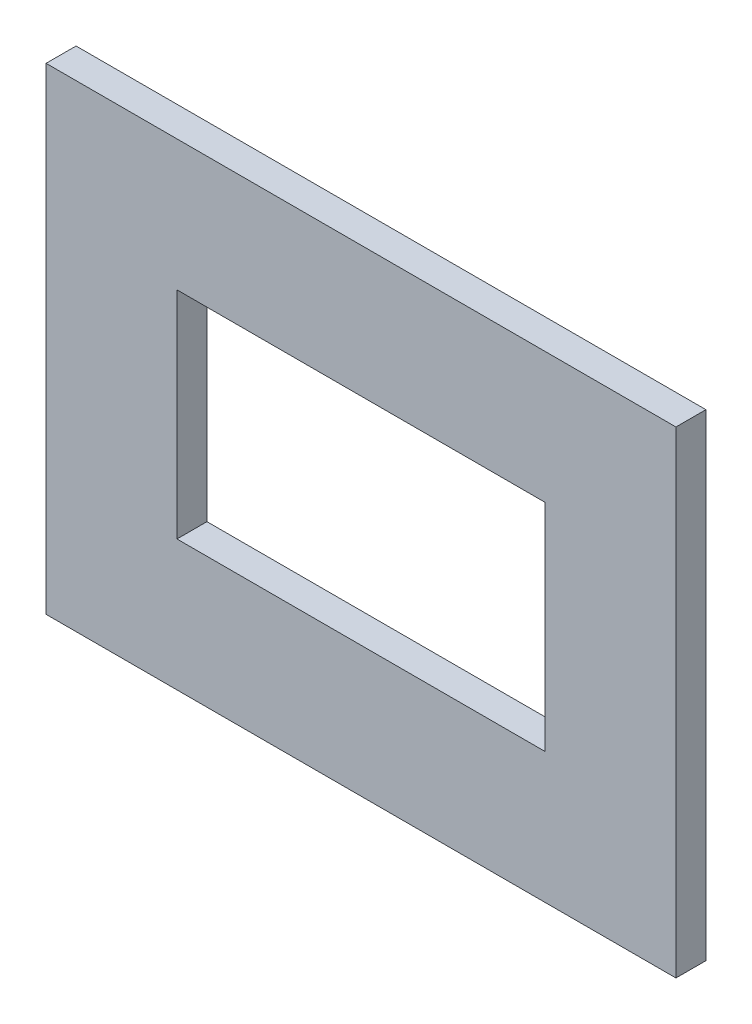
SolidWorks part; units mm, degrees
ref_plane "Front Plane" through (0, 0, 0) normal (0, 0, 1) x (1, 0, 0)
ref_plane "Top Plane" through (0, 0, 0) normal (0, 1, 0) x (1, 0, 0)
ref_plane "Right Plane" through (0, 0, 0) normal (1, 0, 0) x (0, 0, -1)
sketch "Sketch1" plane through (0, 0, 0) normal (0, 0, 1) x (1, 0, 0)
  line L1 (92.075, -53.975) -> (-92.075, -53.975)
  line L2 (92.075, -53.975) -> (92.075, 53.975)
  line L3 (92.075, 53.975) -> (-92.075, 53.975)
  line L4 (-92.075, -53.975) -> (-92.075, 53.975)
  line L5 (92.075, -53.975) -> (-92.075, 53.975) construction
  line L6 (92.075, 53.975) -> (-92.075, -53.975) construction
  line L7 (-639.1231, 371.2771) -> (768.3621, 371.2771)
  line L8 (-639.1231, 371.2771) -> (-639.1231, -757.682)
  line L9 (-639.1231, -757.682) -> (768.3621, -757.682)
  line L10 (768.3621, 371.2771) -> (768.3621, -757.682)
  point P0 (0, 0)
  dimension "D1" = 184.15
  dimension "D2" = 107.95
extrude "Boss-Extrude1" add sketch "Sketch1" along normal blind 15
sketch "Sketch2" plane through (0, 0, 0) normal (0, 0, -1) x (-1, 0, 0)
  line L1 (-834.5725, 454.6118) -> (800.2783, 454.6118)
  line L2 (-834.5725, 454.6118) -> (-834.5725, -959.418)
  line L3 (-834.5725, -959.418) -> (800.2783, -959.418)
  line L4 (800.2783, 454.6118) -> (800.2783, -959.418)
  line L5 (-189.0723, 163.765) -> (192.9837, 163.765)
  line L6 (-189.0723, 163.765) -> (-189.0723, -297.4311)
  line L7 (-189.0723, -297.4311) -> (192.9837, -297.4311)
  line L8 (192.9837, 163.765) -> (192.9837, -297.4311)
extrude "Cut-Extrude1" cut sketch "Sketch2" against normal through all
sketch "Sketch3" plane through (0, 0, 0) normal (0, 0, -1) x (-1, 0, 0)
  line L0 (192.9837, 163.765) -> (-189.0723, 163.765) construction
  line L1 (157.5617, -119.3757) -> (-157.5617, -119.3757)
  line L2 (157.5617, -119.3757) -> (157.5617, 119.3757)
  line L3 (157.5617, 119.3757) -> (-157.5617, 119.3757)
  line L4 (-157.5617, -119.3757) -> (-157.5617, 119.3757)
  line L5 (157.5617, -119.3757) -> (-157.5617, 119.3757) construction
  line L6 (157.5617, 119.3757) -> (-157.5617, -119.3757) construction
  line L7 (117.5617, -79.3757) -> (-117.5617, -79.3757) construction
  line L8 (117.5617, -79.3757) -> (117.5617, 79.3757) construction
  line L9 (117.5617, 79.3757) -> (-117.5617, 79.3757) construction
  line L10 (-117.5617, -79.3757) -> (-117.5617, 79.3757) construction
  line L11 (117.5617, -79.3757) -> (-117.5617, 79.3757) construction
  line L12 (117.5617, 79.3757) -> (-117.5617, -79.3757) construction
  line L13 (-189.0723, 163.765) -> (192.9837, 163.765)
  line L14 (-189.0723, 163.765) -> (-189.0723, -297.4311)
  line L15 (-189.0723, -297.4311) -> (192.9837, -297.4311)
  line L16 (192.9837, 163.765) -> (192.9837, -297.4311)
  line L17 (-189.0723, -297.4311) -> (192.9837, -297.4311) construction
  point P0 (0, 0)
  dimension "D1" = 40
  dimension "D2" = 40
extrude "Cut-Extrude2" cut sketch "Sketch3" against normal through all
